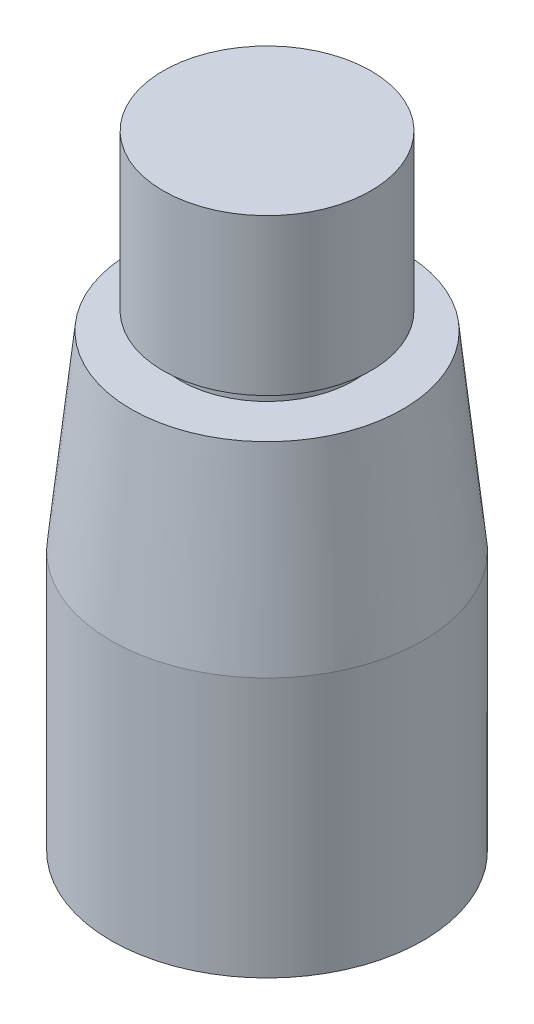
SolidWorks part; units mm, degrees
ref_plane "Front Plane" through (0, 0, 0) normal (0, 0, 1) x (1, 0, 0)
ref_plane "Top Plane" through (0, 0, 0) normal (0, 1, 0) x (1, 0, 0)
ref_plane "Right Plane" through (0, 0, 0) normal (1, 0, 0) x (0, 0, -1)
sketch "Sketch1" plane through (0, 0, 0) normal (0, 0, 1) x (1, 0, 0)
  line L0 (0, 85.1026) -> (0, 0) construction
  line L1 (0, 0) -> (-9, 0)
  line L2 (-9, 0) -> (-9, 15)
  line L3 (-9, 15) -> (-7.8439, 26)
  line L4 (-7.8439, 26) -> (-5, 26)
  line L5 (-5, 26) -> (-5, 27)
  line L6 (-5, 27) -> (-6, 27)
  line L7 (-6, 27) -> (-6, 36)
  line L8 (-6, 36) -> (0, 36)
  line L9 (0, 0) -> (0, 36)
  dimension "D1" = 36
  dimension "D2" = 1
  dimension "D3" = 11
  dimension "D4" = 6
  dimension "D5" = 9
  dimension "D6" = 9
  dimension "D7" = 6
  dimension "D8" = 1
revolve "Revolve1" add sketch "Sketch1" angle 360 about L0
